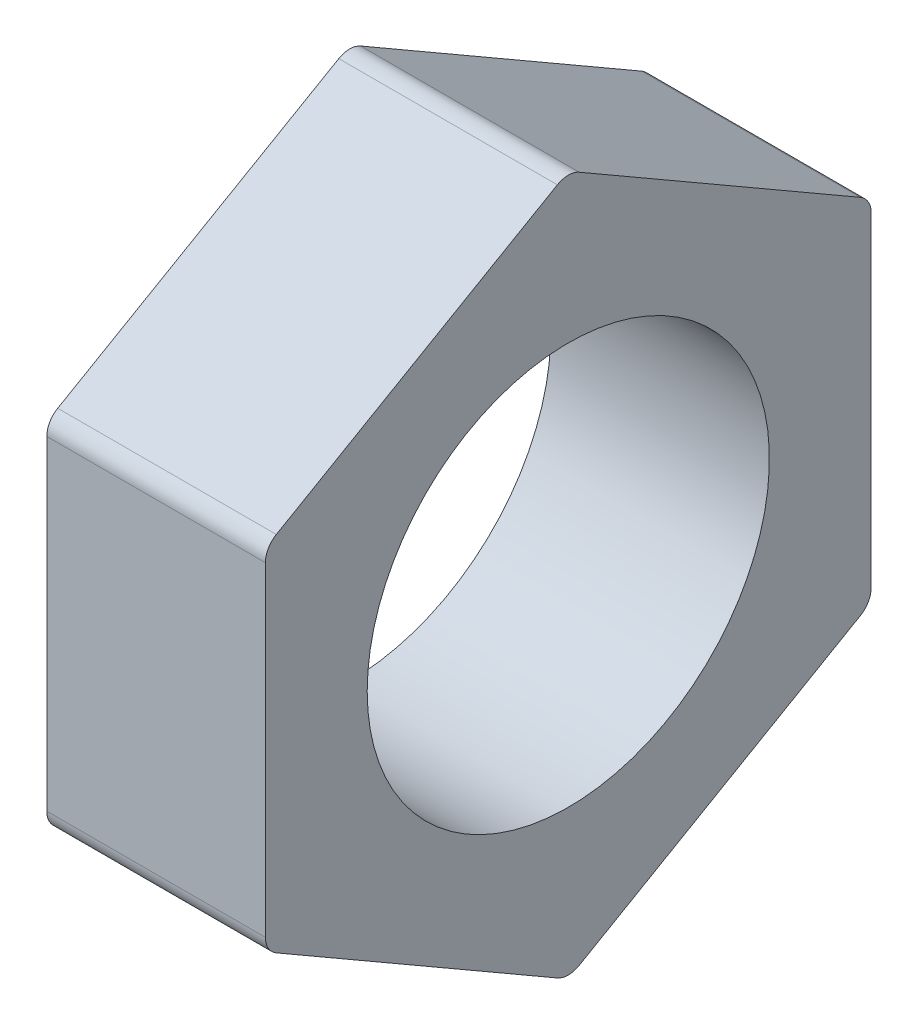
SolidWorks part; units mm, degrees
other "<Bracket Nut>-<Boss-Extrude1>"
ref_plane "Front Plane" through (0, 0, 0) normal (0, 0, 1) x (1, 0, 0)
ref_plane "Top Plane" through (0, 0, 0) normal (0, 1, 0) x (1, 0, 0)
ref_plane "Right Plane" through (0, 0, 0) normal (1, 0, 0) x (0, 0, -1)
mirrored part "Bracket Nut_Mirrored"
